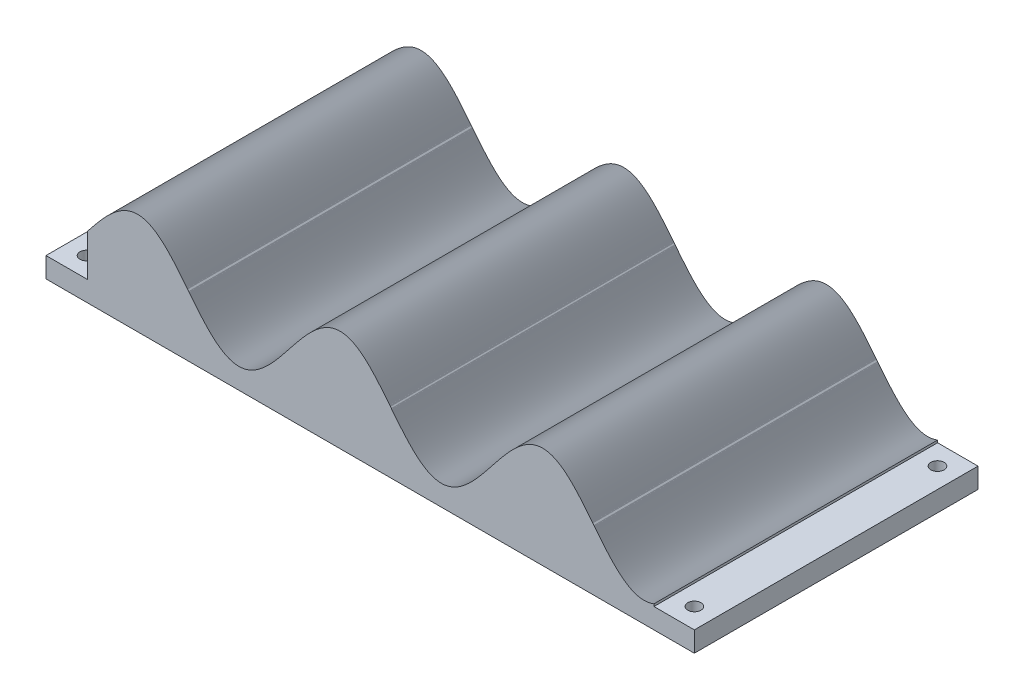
SolidWorks part; units mm, degrees
ref_plane "Front Plane" through (0, 0, 0) normal (0, 0, 1) x (1, 0, 0)
ref_plane "Top Plane" through (0, 0, 0) normal (0, 1, 0) x (1, 0, 0)
ref_plane "Right Plane" through (0, 0, 0) normal (1, 0, 0) x (0, 0, -1)
sketch "Model"
  dimension "D1" = 10
  dimension "D2" = 320
  dimension "D3" = 20
extrude "Boss-Extrude1" add sketch "Model" along normal blind 140
sketch "Sketch1" plane through (0, -10, 0) normal (0, -1, 0) x (1, 0, 0)
  line L0 (140, 140) -> (140, 0) construction
  line L2 (-20, 140) -> (300, 140) construction
  line L3 (-20, 0) -> (300, 0) construction
  line L5 (300, 140) -> (300, 0) construction
  line L6 (300, 70) -> (-20, 70) construction
  line L7 (-20, 140) -> (-20, 0) construction
  circle A0 centre (-10, 130) radius 3.25
  circle A1 centre (290, 130) radius 3.25
  circle A2 centre (290, 10) radius 3.25
  circle A3 centre (-10, 10) radius 3.25
  dimension "D1" = 6.5
  dimension "D2" = 10
  dimension "D3" = 10
extrude "Cut-Extrude1" cut sketch "Sketch1" against normal through all both and the other way through all
